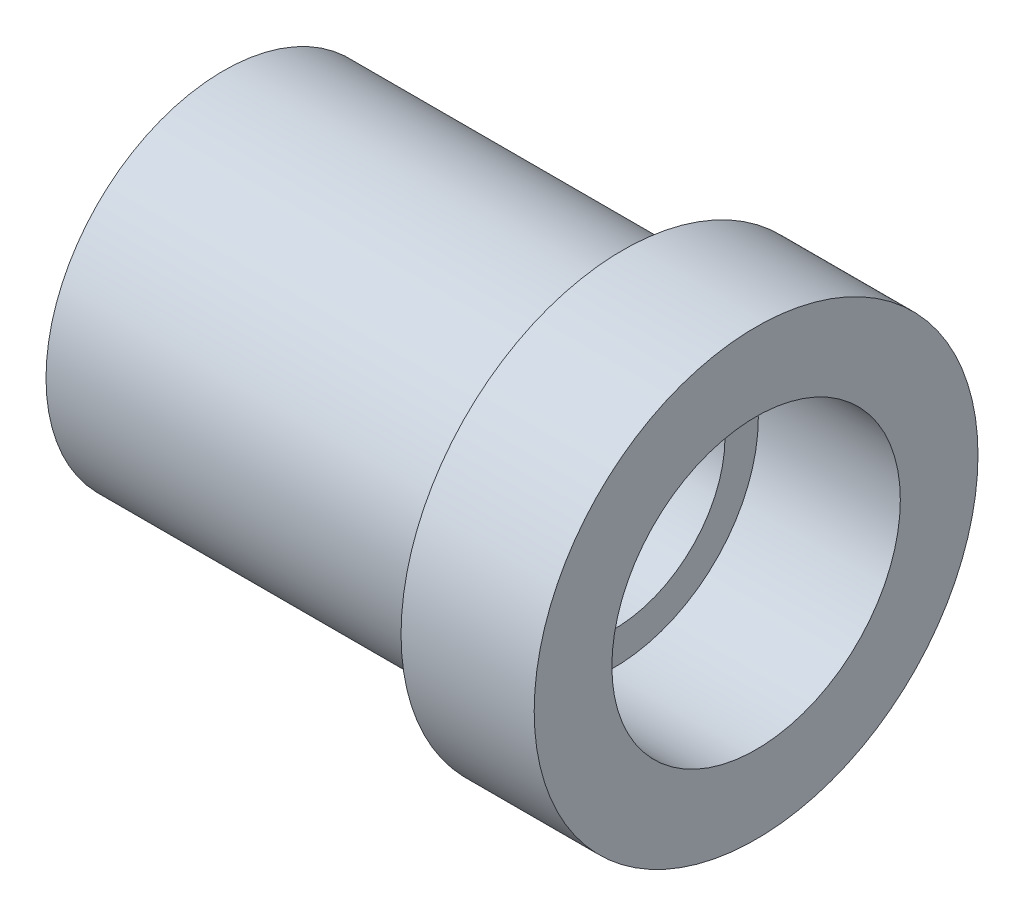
SolidWorks part; units mm, degrees
ref_plane "Plan de face" through (0, 0, 0) normal (0, 0, 1) x (1, 0, 0)
ref_plane "Plan de dessus" through (0, 0, 0) normal (0, 1, 0) x (1, 0, 0)
ref_plane "Plan de droite" through (0, 0, 0) normal (1, 0, 0) x (0, 0, -1)
sketch "Esquisse1" plane through (0, 0, 0) normal (0, 0, 1) x (1, 0, 0)
  line L0 (27.6282, 4) -> (27.6282, 5)
  line L1 (18.6282, 0) -> (30.6282, 0)
  line L2 (18.6282, 0) -> (18.6282, 4)
  line L3 (18.6282, 4) -> (27.6282, 4)
  line L4 (30.6282, 0) -> (30.6282, 1.7335)
  line L5 (27.6282, 5) -> (30.6282, 5)
  line L6 (30.6282, 5) -> (30.6282, 1.7335)
  line L7 (-32.7627, 0) -> (46.4546, 0) construction
  dimension "D2" = 4
  dimension "D3" = 3
  dimension "D4" = 5
  dimension "D5" = 12
revolve "Révolution1" add sketch "Esquisse1" angle 360 about L7
hole_wizard "Trou taraudé M6x1.02" positions "Esquisse6" profile "Esquisse5" tap size "M6x1.0" standard "ISO"
sketch "Esquisse6" plane through (30.6282, 0, 0) normal (1, 0, 0) x (0, 0, -1)
  circle A0 centre (0, 0) radius 5 construction
  point P0 (0, 0)
sketch "Esquisse5" plane through (30.6282, 0, 0) normal (0, 1, 0) x (0, 0, -1)
  line L0 (0, 0) -> (0, 12)
  line L1 (0, 12) -> (2.5, 12)
  line L2 (2.5, 12) -> (2.5, 0)
  line L5 (2.5, 0) -> (0, 0)
  line L11 (0, -6.35) -> (0, 107.95) construction
  dimension "Diamètre du trou pour taraudage jusqu'au prochain" = 5
  dimension "Profondeur du trou pour taraudage jusqu'au prochain" = 12
sketch "Esquisse7" plane through (30.6282, 0, 0) normal (1, 0, 0) x (0, 0, -1)
  circle A0 centre (0, 0) radius 3.25
  dimension "D1" = 6.5
extrude "Enlèv. mat.-Extru.1" cut sketch "Esquisse7" against normal blind 3.2
